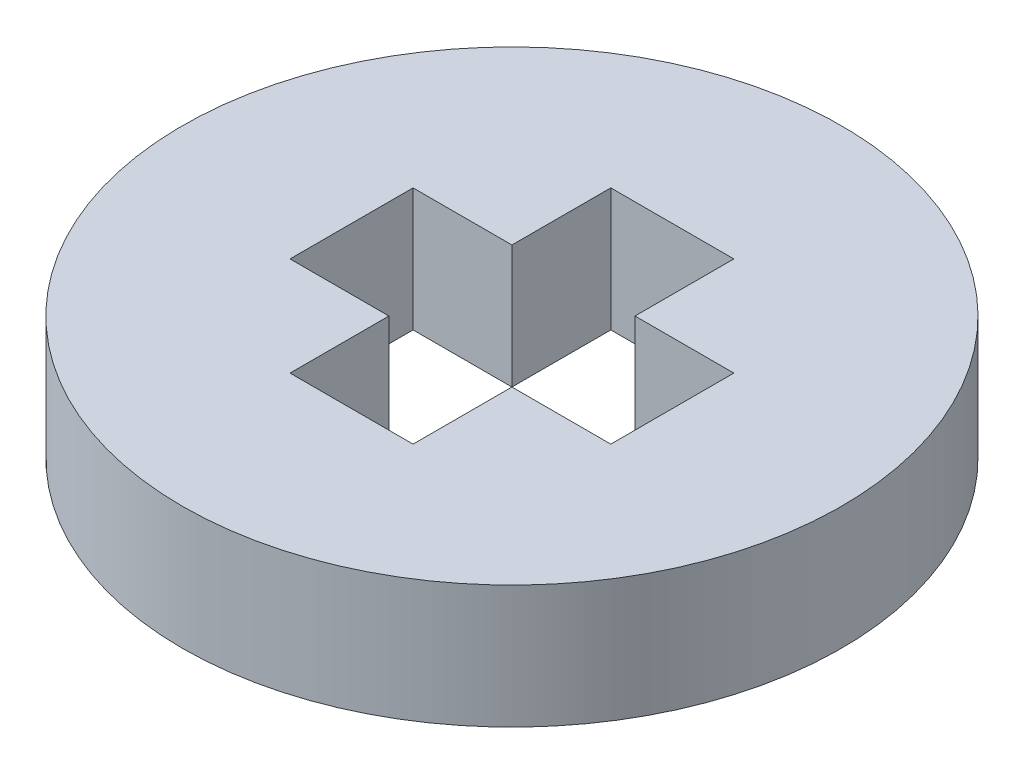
SolidWorks part; units mm, degrees
ref_plane "Front Plane" through (0, 0, 0) normal (0, 0, 1) x (1, 0, 0)
ref_plane "Top Plane" through (0, 0, 0) normal (0, 1, 0) x (1, 0, 0)
ref_plane "Right Plane" through (0, 0, 0) normal (1, 0, 0) x (0, 0, -1)
sketch "Sketch1" plane through (0, 0, 0) normal (0, 1, 0) x (1, 0, 0)
  line L0 (1.4, 3.65) -> (-1.4, 3.65)
  line L1 (-1.4, 3.65) -> (-1.4, 1.4)
  line L2 (-1.4, 1.4) -> (-3.65, 1.4)
  line L3 (-3.65, 1.4) -> (-3.65, -1.4)
  line L4 (-3.65, -1.4) -> (-1.4, -1.4)
  line L5 (-1.4, -1.4) -> (-1.4, -3.65)
  line L6 (-1.4, -3.65) -> (1.4, -3.65)
  line L7 (1.4, -3.65) -> (1.4, -1.4)
  line L8 (1.4, -1.4) -> (3.65, -1.4)
  line L9 (3.65, -1.4) -> (3.65, 1.4)
  line L10 (3.65, 1.4) -> (1.4, 1.4)
  line L11 (1.4, 1.4) -> (1.4, 3.65)
  line L12 (-11.9147, 0) -> (11.2297, 0) construction
  line L13 (0, 7.3764) -> (0, -9.9208) construction
  circle A0 centre (0, 0) radius 7.5
extrude "Boss-Extrude1" add sketch "Sketch1" along normal blind 2.8
equation "\"mdf\" = 3mm - \"kerf\"'chess table material"
equation "\"diameter\"= ( 25mm - 5mm )'diameter of all of the pieces in relation with the chess table"
equation "\"size press fit\"= 5mm"
equation "\"gap\" = ( ( \"diameter\" - ( \"size press fit\" * 3 ) ) / 4mm ) + \"kerf\""
equation "\"gap press fit\" = ( \"diameter\" - \"size press fit\" - \"size press fit\" - \"gap\" - \"gap\" ) + \"kerf\""
equation "\"D1@Boss-Extrude1\"=\"mdf\""
equation "\"gap y\"= \"gap\" + 1mm"
equation "\"kerf\"= 0.2"
equation "\"D3@Sketch1\"=\"mdf\""
equation "\"D2@Sketch1\"=\"mdf\""
equation "\"D4@Sketch1\"=\"gap press fit\""
equation "\"D5@Sketch1\"=\"gap press fit\""
